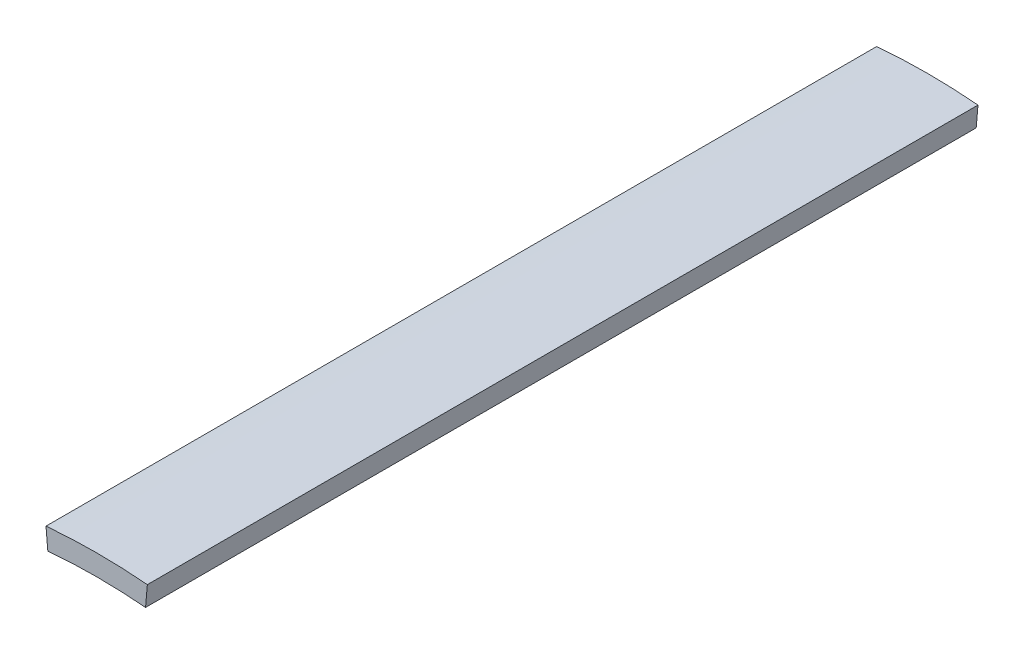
SolidWorks part; units mm, degrees
ref_plane "Face" through (0, 0, 0) normal (0, 0, 1) x (1, 0, 0)
ref_plane "Dessus" through (0, 0, 0) normal (0, 1, 0) x (1, 0, 0)
ref_plane "Droite" through (0, 0, 0) normal (1, 0, 0) x (0, 0, -1)
sketch "Esquisse1" plane through (0, 0, 0) normal (0, 0, 1) x (1, 0, 0)
  line L0 (0, 0) -> (0, 19.4664) construction
  line L1 (-0.5883, 6.7243) -> (-0.6101, 6.9734)
  line L2 (0.5883, 6.7243) -> (0.6101, 6.9734)
  arc A0 (0.5883, 6.7243) -> (-0.5883, 6.7243) centre (0, 0) ccw
  arc A1 (-0.6101, 6.9734) -> (0.6101, 6.9734) centre (0, 0) cw
  dimension "D1" = 6.75
  dimension "D2" = 7
  dimension "D3" = 10
extrude "Boss.-Extru.1" add sketch "Esquisse1" along normal blind 10
